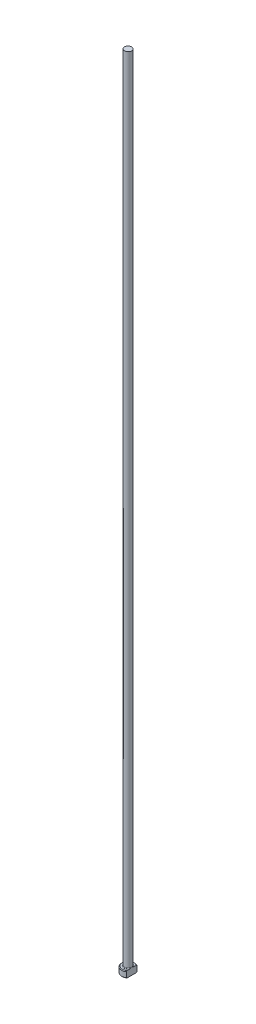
SolidWorks part; units mm, degrees
ref_plane "Front Plane" through (0, 0, 0) normal (0, 0, 1) x (1, 0, 0)
ref_plane "Top Plane" through (0, 0, 0) normal (0, 1, 0) x (1, 0, 0)
ref_plane "Right Plane" through (0, 0, 0) normal (1, 0, 0) x (0, 0, -1)
sketch "Sketch1" plane through (0, 0, 0) normal (0, 0, 1) x (1, 0, 0)
  line L0 (0, 259.9588) -> (0, -15.1925) construction
  line L1 (0, 0) -> (-2, 0)
  line L2 (-2, 0) -> (-2, 2)
  line L3 (-2, 2) -> (-1.1, 2)
  line L4 (-1.1, 2) -> (-1.1, 250)
  line L5 (-1.1, 250) -> (0, 250)
  line L6 (0, 250) -> (0, 0)
  dimension "L" = 250
  dimension "H" = 4
  dimension "T" = 2
  dimension "D" = 2.2
revolve "Revolve1" add sketch "Sketch1" angle 360 about L0
chamfer "Chamfer1" distance 0.2 angle 45 2 edges at (0, 2, 2) (0, 0, 2)
fillet "Fillet1" radius 0.2 1 edges at (0, 2, 1.1)
sketch "Sketch2" plane through (0, 0, 0) normal (0, 1, 0) x (1, 0, 0)
  line L0 (1.1, 1.6703) -> (1.1, -1.6703)
  circle A0 centre (0, 0) radius 2 construction
  arc A1 (1.1, -1.6703) -> (1.1, 1.6703) centre (0, 0) ccw
  circle A2 centre (0, 0) radius 1.1 construction
extrude "KEY" cut sketch "Sketch2" along normal through all
